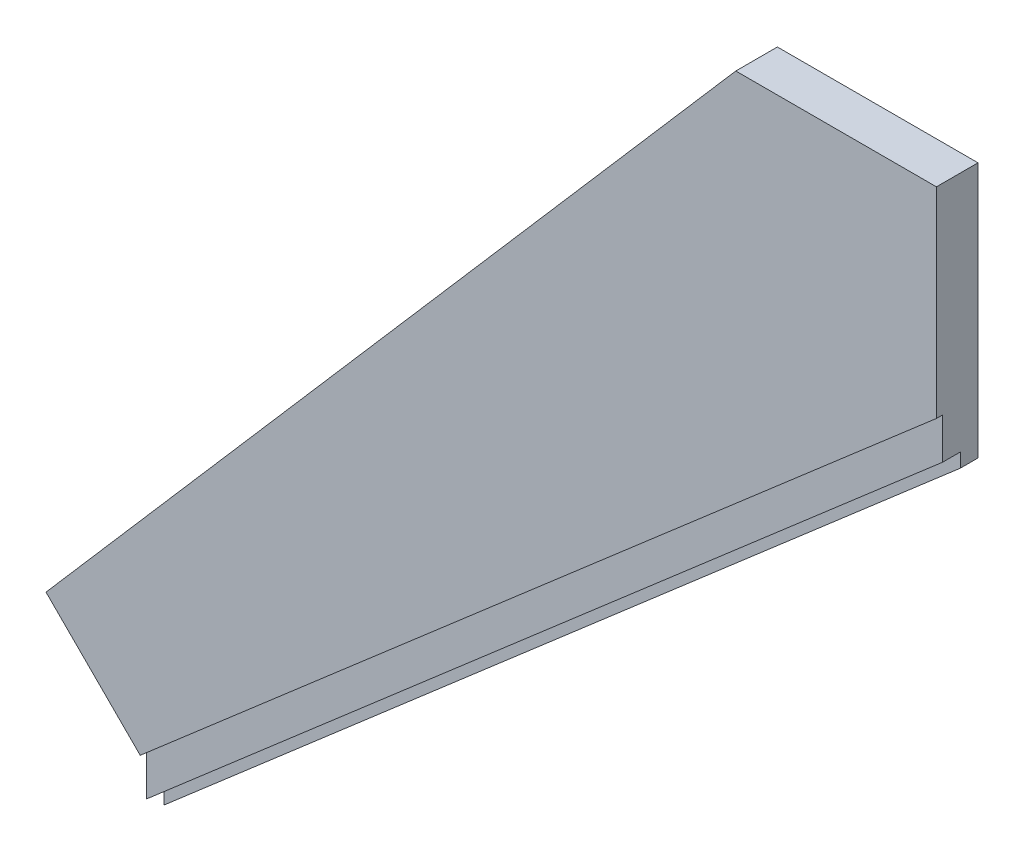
SolidWorks part; units mm, degrees
ref_plane "Спереди" through (0, 0, 0) normal (0, 0, 1) x (1, 0, 0)
ref_plane "Сверху" through (0, 0, 0) normal (0, 1, 0) x (1, 0, 0)
ref_plane "Справа" through (0, 0, 0) normal (1, 0, 0) x (0, 0, -1)
sketch "Эскиз1" plane through (0, 0, 0) normal (0, 0, 1) x (1, 0, 0)
  line L0 (0, 0) -> (-226.7832, 0)
  line L1 (0, 0) -> (0, -226.7832)
  line L16 (0, -226.7832) -> (-900, -1006.4871)
  line L17 (-226.7832, 0) -> (-1006.4871, -900)
  line L28 (-1006.4871, -900) -> (-900, -1006.4871)
extrude "Вытянуть1" add sketch "Эскиз1" along normal blind 47
sketch "Эскиз2" plane through (0, 0, 0) normal (0, 0, -1) x (-1, 0, 0)
  line L0 (0, -226.7832) -> (0, -273.091)
  line L1 (900, -1006.4871) -> (900, -1052.7949)
  line L2 (900, -1052.7949) -> (0, -273.091)
  line L3 (900, -1006.4871) -> (0, -226.7832) construction
  line L9 (0, 0) -> (0, -226.7832)
  line L10 (0, -226.7832) -> (900, -1006.4871)
  line L11 (900, -1006.4871) -> (1006.4871, -900)
  line L12 (1006.4871, -900) -> (226.7832, 0)
  line L13 (226.7832, 0) -> (0, 0)
  line L15 (0, -226.7832) -> (900, -1006.4871)
  dimension "D1" = 35
  dimension "D2" = 0
extrude "Вытянуть2" add sketch "Эскиз2" against normal blind 40
sketch "Эскиз3" plane through (0, 0, 0) normal (0, 0, -1) x (-1, 0, 0)
  line L0 (0, -273.091) -> (0, -288.968)
  line L1 (900, -1052.7949) -> (900, -1068.6718)
  line L2 (900, -1068.6718) -> (0, -288.968)
  line L3 (0, -273.091) -> (900, -1052.7949) construction
  line L10 (0, 0) -> (0, -273.091)
  line L11 (0, -273.091) -> (900, -1052.7949)
  line L12 (900, -1052.7949) -> (900, -1006.4871)
  line L13 (900, -1006.4871) -> (1006.4871, -900)
  line L14 (1006.4871, -900) -> (226.7832, 0)
  line L15 (226.7832, 0) -> (0, 0)
  line L17 (0, -273.091) -> (900, -1052.7949)
  dimension "D1" = 12
  dimension "D2" = 0
extrude "Вытянуть3" add sketch "Эскиз3" against normal blind 20
